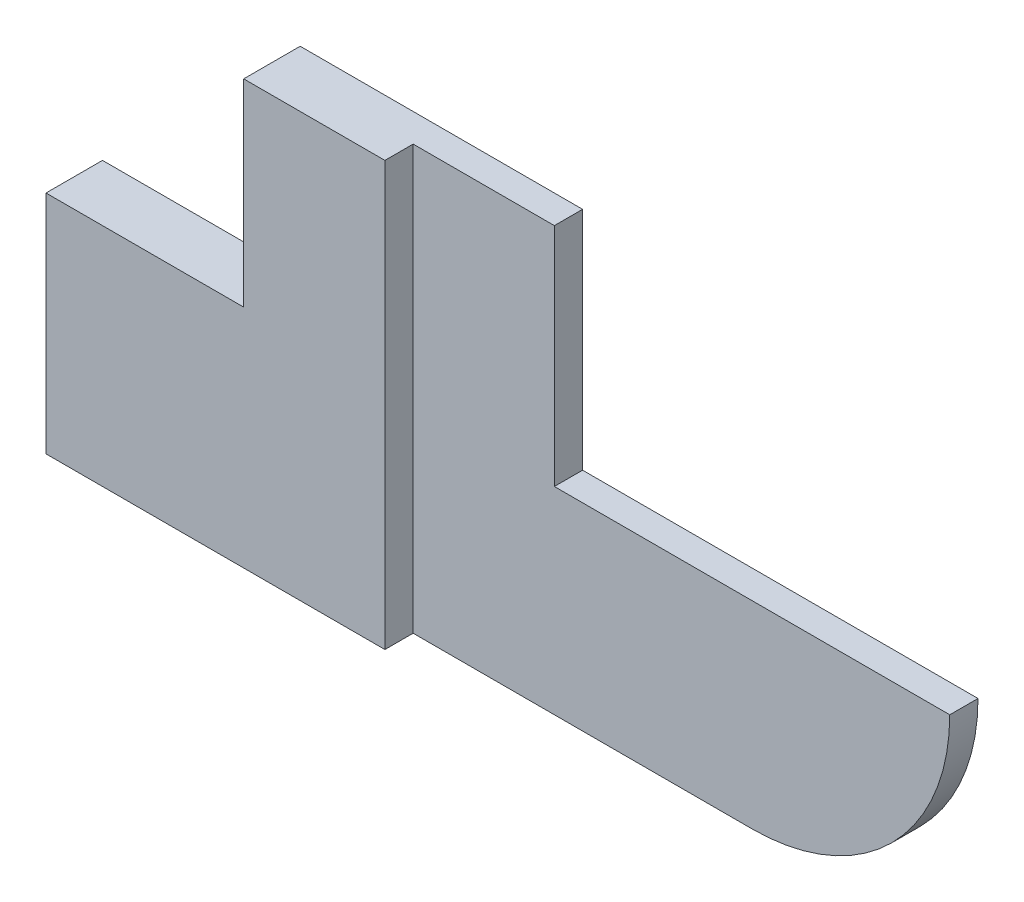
SolidWorks part; units mm, degrees
ref_plane "Front Plane" through (0, 0, 0) normal (0, 0, 1) x (1, 0, 0)
ref_plane "Top Plane" through (0, 0, 0) normal (0, 1, 0) x (1, 0, 0)
ref_plane "Right Plane" through (0, 0, 0) normal (1, 0, 0) x (0, 0, -1)
sketch "Sketch1" plane through (0, 0, 0) normal (0, 0, 1) x (1, 0, 0)
  line L0 (0, 0) -> (0, 40)
  line L1 (0, 40) -> (35, 40)
  line L2 (35, 40) -> (35, 75)
  line L3 (35, 75) -> (85, 75)
  line L4 (85, 75) -> (85, 35)
  line L5 (85, 35) -> (155, 35)
  line L6 (120, 0) -> (0, 0)
  arc A0 (155, 35) -> (120, 0) centre (120, 35) cw
  dimension "D3" = 35
  dimension "D1" = 120
  dimension "D2" = 40
  dimension "D4" = 50
  dimension "D5" = 35
  dimension "D6" = 70
extrude "Extrude1" add sketch "Sketch1" along normal blind 10
sketch "Sketch2" plane through (0, 0, 10) normal (0, 0, 1) x (1, 0, 0)
  line L0 (85, 75) -> (35, 75) construction
  line L1 (60, 75) -> (155, 75)
  line L2 (60, 75) -> (60, 0)
  line L3 (60, 0) -> (155, 0)
  line L4 (155, 75) -> (155, 0)
  line L5 (0, 0) -> (120, 0) construction
extrude "Cut-Extrude1" cut sketch "Sketch2" against normal blind 5
sketch "Sketch3" plane through (0, 0, 10) normal (0, 0, 1) x (1, 0, 0)
  line L1 (25, 30) -> (45, 30)
  line L2 (25, 30) -> (25, 10)
  line L3 (25, 10) -> (45, 10)
  line L4 (45, 30) -> (45, 10)
  line L5 (60, 75) -> (60, 0) construction
  line L6 (0, 0) -> (60, 0) construction
  line L7 (60, 75) -> (60, 0) construction
  line L8 (95, 30) -> (75, 30)
  line L9 (75, 30) -> (75, 10)
  line L10 (95, 10) -> (75, 10)
  line L11 (95, 30) -> (95, 10)
  dimension "D1" = 20
  dimension "D2" = 15
  dimension "D3" = 10
